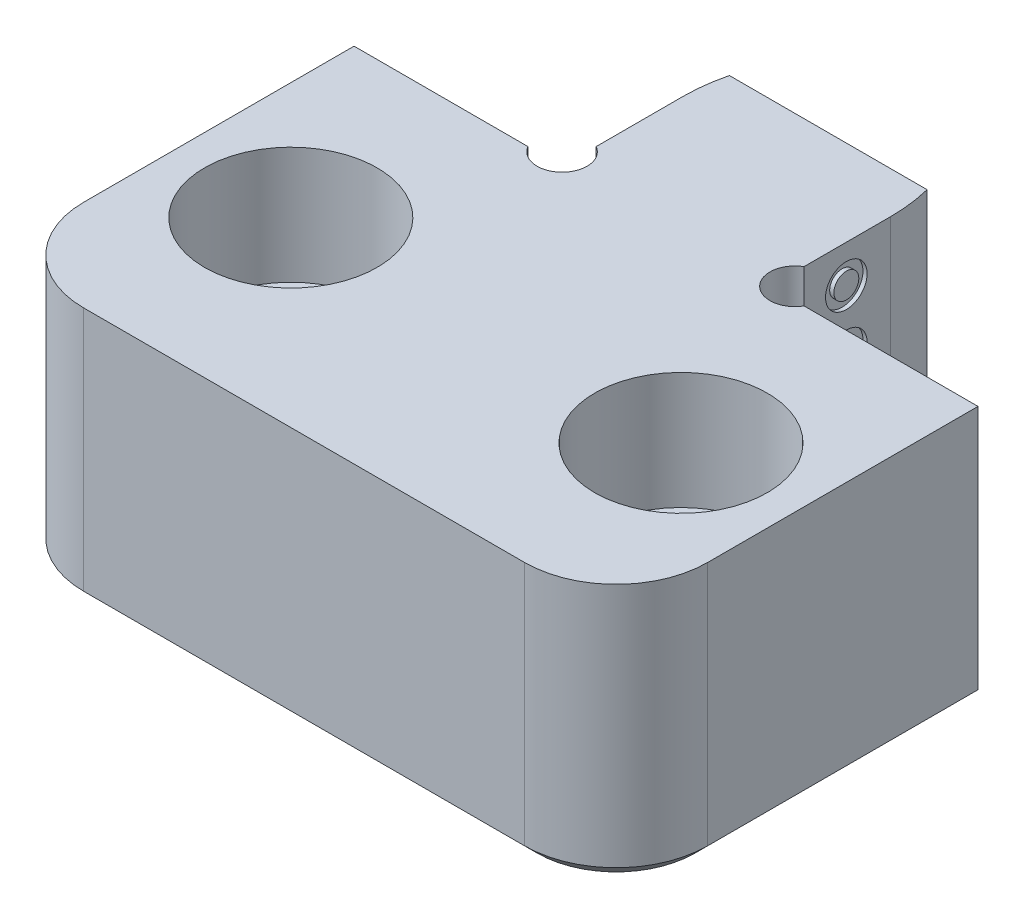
SolidWorks part; units mm, degrees
ref_plane "Front Plane" through (0, 0, 0) normal (0, 0, 1) x (1, 0, 0)
ref_plane "Top Plane" through (0, 0, 0) normal (0, 1, 0) x (1, 0, 0)
ref_plane "Right Plane" through (0, 0, 0) normal (1, 0, 0) x (0, 0, -1)
sketch "Sketch1" plane through (0, 0, 0) normal (0, 1, 0) x (1, 0, 0)
  line L0 (-19.05, -22.098) -> (19.05, -22.098)
  line L6 (-6.3475, 0) -> (-6.3475, 7.366)
  line L7 (-6.0355, 9.906) -> (6.0355, 9.906)
  line L8 (6.3475, 7.366) -> (6.3475, 0)
  line L9 (6.3475, 0) -> (19.05, 0)
  line L10 (19.05, 0) -> (19.05, -22.098)
  line L12 (0, 0) -> (0, 50000) construction
  line L13 (0, 0) -> (-50000, 0) construction
  line L21 (-19.05, 0) -> (-19.05, -22.098)
  line L22 (-6.3475, 0) -> (-19.05, 0)
  arc A0 (-6.3475, 7.366) -> (-6.0355, 9.906) centre (4.1504, 7.366) cw
  arc A1 (6.3475, 7.366) -> (6.0355, 9.906) centre (-4.1504, 7.366) ccw
  dimension "D5" = 2.54
  dimension "D6" = 10.4978
  dimension "D1" = 12.6949
  dimension "D2" = 22.098
  dimension "D3" = 32.004
  dimension "D4" = 38.1
extrude "Boss-Extrude1" add sketch "Sketch1" against normal blind 15.748 separate body
sketch "Sketch3" plane through (0, 0, 0) normal (0, 1, 0) x (1, 0, 0)
  line L0 (0, 0) -> (0, 50000) construction
  line L1 (0, 0) -> (50000, 0) construction
  line L6 (19.05, -0.762) -> (6.3475, -0.762)
  line L7 (19.05, -0.762) -> (6.3475, -0.762) construction
  line L9 (5.5855, 0) -> (5.5855, 7.366)
  line L10 (5.5855, 0) -> (5.5855, 7.366) construction
  circle A0 centre (7.1095, 0.762) radius 1.524
  circle A1 centre (-7.1095, 0.762) radius 1.524
  dimension "D1" = 1.524
  dimension "D2" = 0.762
  dimension "D3" = 0.762
extrude "Cut-Extrude2" cut sketch "Sketch3" against normal through all
sketch "Sketch5" plane through (19.05, 0, 0) normal (1, 0, 0) x (0, 0, -1)
  line L0 (-63.088, -15.494) -> (49936.912, -15.494) construction
  line L1 (-22.098, -15.748) -> (0, -15.748) construction
  line L3 (0, 9.7237) -> (0, -49990.2763) construction
  line L4 (0, -15.748) -> (0, 0) construction
  line L5 (-11.049, 0) -> (-11.049, 50000) construction
  line L6 (-22.098, 0) -> (0, 0) construction
  line L7 (0, -15.494) -> (0, -31.0652)
  line L8 (0, -15.494) -> (2.286, -15.494)
  line L9 (50.8, 7.0348) -> (50.8, -31.0652)
  line L10 (50.8, -31.0652) -> (0, -31.0652)
  line L11 (9.906, -15.748) -> (9.906, 0) construction
  arc A0 (2.286, -15.494) -> (50.8, 7.0348) centre (2.286, 48.006) ccw
  point P16 (-11.049, 0)
  dimension "D2" = 63.5
  dimension "D3" = 7.62
  dimension "D1" = 0.254
  dimension "D4" = 38.1
  dimension "D5" = 50.8
extrude "Cut-Extrude3" cut sketch "Sketch5" against normal through all
fillet "Fillet1" radius 5.588 2 edges at (-19.05, -7.874, 22.098) (19.05, -7.874, 22.098)
chamfer "Chamfer3" distance 0.762 angle 45 5 edges at (-19.05, -15.748, 8.255) (-17.4133, -15.748, 20.4613) (0, -15.748, 22.098) (17.4133, -15.748, 20.4613) (19.05, -15.748, 8.255)
hole_wizard "1/4\" CBORE" positions "Sketch7" profile "Sketch6" counterbore size "1/4" standard "ANSI Inch"
sketch "Sketch7" plane through (0, 0, 0) normal (0, 1, 0) x (-1, 0, 0)
  line L0 (0, 0) -> (0, 50000) construction
  line L1 (0, 0) -> (50000, 0) construction
  line L2 (19.05, 0) -> (19.05, 16.51) construction
  line L3 (13.462, 22.098) -> (-13.462, 22.098) construction
  point P0 (11.9126, 10.9982)
  point P16 (-11.9126, 10.9982)
  dimension "D1" = 7.1374
  dimension "D2" = 11.0998
sketch "Sketch6" plane through (-11.9126, 0, 10.9982) normal (1, 0, 0) x (0, 0, 1)
  line L0 (0, 0) -> (0, 15.748)
  line L1 (0, 15.748) -> (3.5687, 15.748)
  line L3 (3.5687, 15.748) -> (3.5687, 7.145)
  line L4 (3.5687, 7.145) -> (5.2705, 7.145)
  line L5 (5.2705, 7.145) -> (5.2705, 0)
  line L7 (5.2705, 0) -> (0, 0)
  line L11 (0, -6.35) -> (0, 107.95) construction
  dimension "Thru Hole Dia." = 7.1374
  dimension "Thru Hole Depth" = 15.748
  dimension "C'Bore Dia." = 10.541
  dimension "C'Bore Depth" = 7.145
sketch "Sketch8" plane through (6.3475, 0, 0) normal (1, 0, 0) x (0, 0, -1)
  circle A0 centre (4.662, -2.2921) radius 1.27
  circle A1 centre (4.662, -2.2921) radius 0.762
  circle A6 centre (4.662, -5.9154) radius 1.27
  circle A7 centre (4.662, -5.9154) radius 0.762
  circle A8 centre (4.662, -12.7254) radius 1.27
  circle A9 centre (4.662, -12.7254) radius 0.762
  circle A14 centre (4.662, -9.495) radius 1.27
  circle A15 centre (4.662, -9.495) radius 0.762
extrude "Cut-Extrude4" cut sketch "Sketch8" against normal blind 0.254
mirror "Mirror1" about plane through (0, 0, 0) normal (1, 0, 0) of "Cut-Extrude4"
